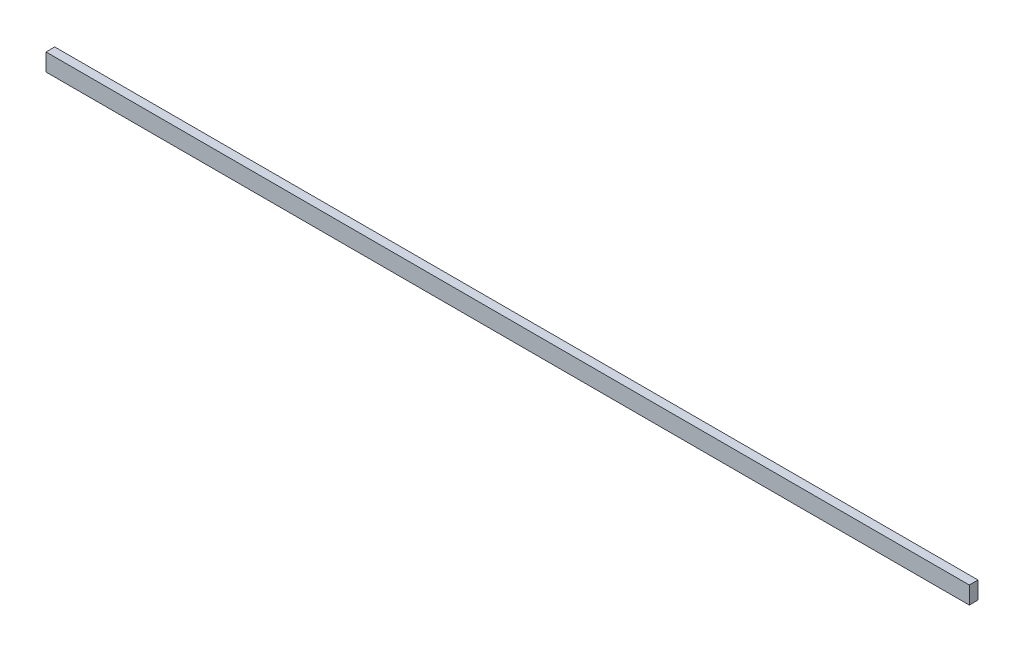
SolidWorks part; units mm, degrees
ref_plane "Face" through (0, 0, 0) normal (0, 0, 1) x (1, 0, 0)
ref_plane "Dessus" through (0, 0, 0) normal (0, 1, 0) x (1, 0, 0)
ref_plane "Droite" through (0, 0, 0) normal (1, 0, 0) x (0, 0, -1)
sketch "Esquisse1" plane through (0, 0, 0) normal (1, 0, 0) x (0, 0, -1)
  line L1 (0, 0) -> (5, 0)
  line L2 (0, 0) -> (0, 10)
  line L3 (0, 10) -> (5, 10)
  line L4 (5, 0) -> (5, 10)
  dimension "D1" = 5
  dimension "D2" = 10
extrude "Extrusion1" add sketch "Esquisse1" along normal blind 530
